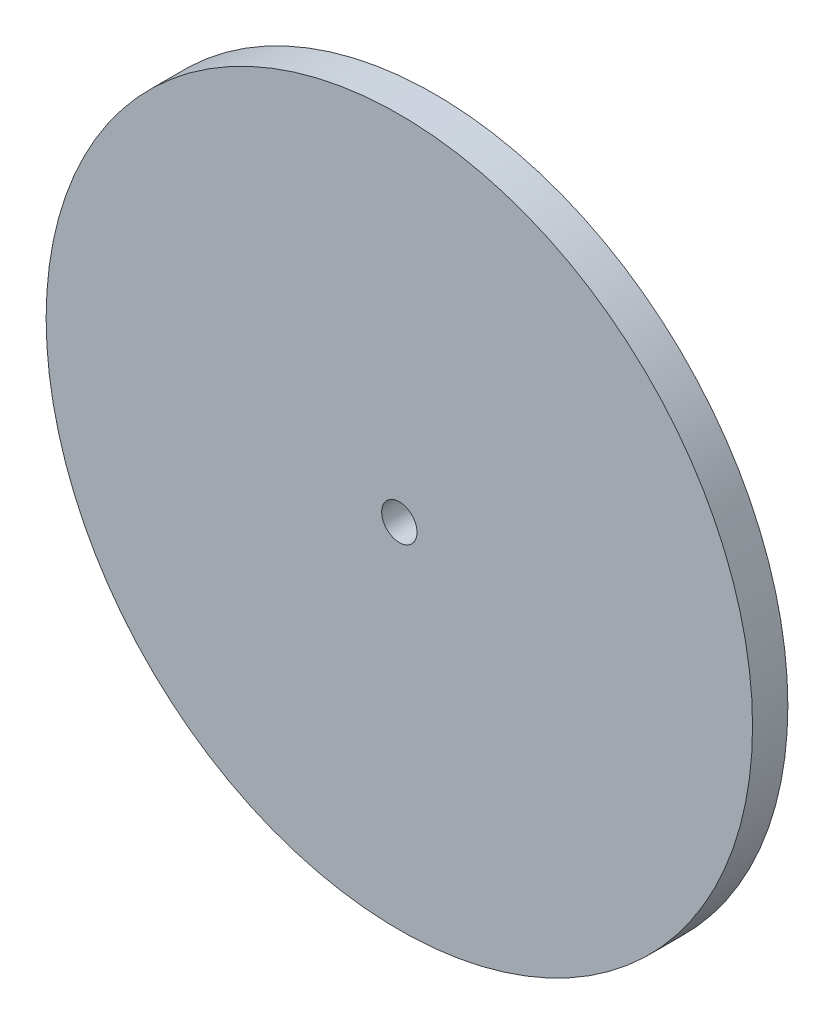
SolidWorks part; units mm, degrees
ref_plane "前视基准面" through (0, 0, 0) normal (0, 0, 1) x (1, 0, 0)
ref_plane "上视基准面" through (0, 0, 0) normal (0, 1, 0) x (1, 0, 0)
ref_plane "右视基准面" through (0, 0, 0) normal (1, 0, 0) x (0, 0, -1)
sketch "草图3" plane through (0, 0, 0) normal (0, 0, 1) x (1, 0, 0)
  circle A0 centre (0, 0) radius 300
  circle A1 centre (0, 0) radius 15
extrude "凸台-拉伸1" add sketch "草图3" along normal blind 30
